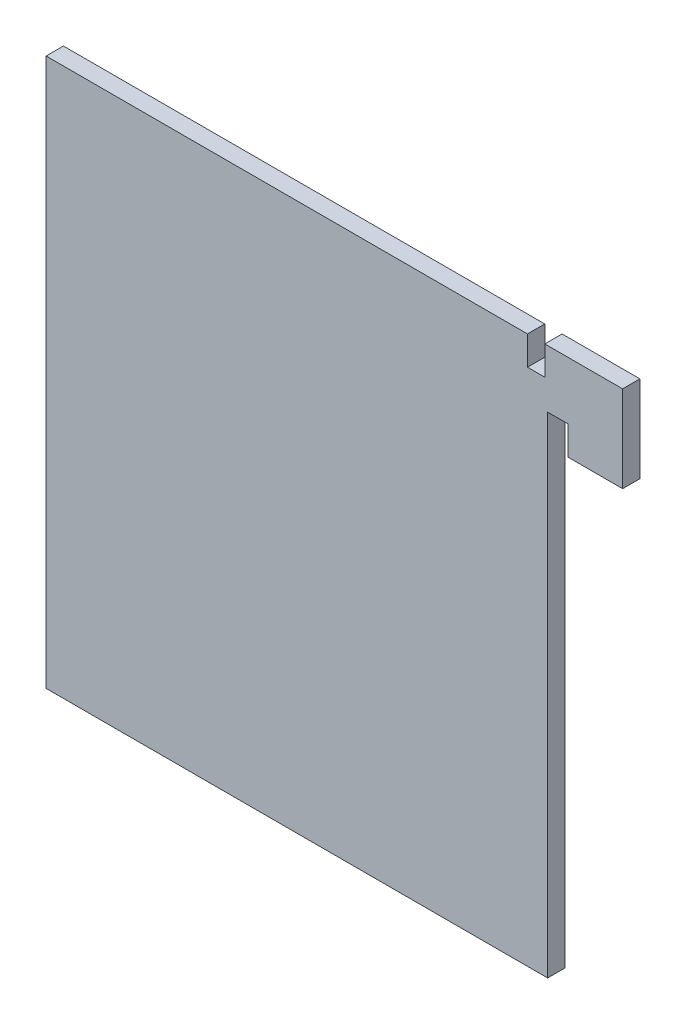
SolidWorks part; units mm, degrees
ref_plane "Plan de face" through (0, 0, 0) normal (0, 0, 1) x (1, 0, 0)
ref_plane "Plan de dessus" through (0, 0, 0) normal (0, 1, 0) x (1, 0, 0)
ref_plane "Plan de droite" through (0, 0, 0) normal (1, 0, 0) x (0, 0, -1)
sketch "Esquisse1" plane through (0, 0, 0) normal (0, 0, 1) x (1, 0, 0)
  line L1 (0, 0) -> (100, 0)
  line L2 (0, 0) -> (0, 95)
  line L3 (0, 95) -> (100, 95)
  line L4 (100, 0) -> (100, 95)
  dimension "D1" = 100
  dimension "D2" = 95
extrude "Extrusion1" add sketch "Esquisse1" along normal blind 3
sketch "Esquisse2" plane through (0, 0, 3) normal (0, 0, 1) x (1, 0, 0)
  line L0 (100, 95) -> (0, 95) construction
  line L1 (83.5, 95) -> (86.5, 95)
  line L2 (83.5, 95) -> (83.5, 90)
  line L3 (83.5, 90) -> (86.5, 90)
  line L4 (86.5, 95) -> (86.5, 90)
  line L5 (100, 0) -> (100, 95) construction
  line L6 (100, 80) -> (87, 80)
  line L7 (100, 80) -> (100, 0)
  line L8 (100, 0) -> (87, 0)
  line L9 (87, 80) -> (87, 0)
  line L10 (0, 0) -> (100, 0) construction
  dimension "D1" = 3
  dimension "D2" = 5
  dimension "D3" = 13.5
  dimension "D4" = 80
  dimension "D5" = 13
extrude "Enlèv. mat.-Extru.1" cut sketch "Esquisse2" against normal blind 3
sketch "Esquisse3" plane through (0, 0, 3) normal (0, 0, 1) x (1, 0, 0)
  line L1 (87, 80) -> (90.5, 80)
  line L2 (87, 80) -> (87, 85)
  line L3 (87, 85) -> (90.5, 85)
  line L4 (90.5, 80) -> (90.5, 85)
  dimension "D1" = 5
  dimension "D2" = 3.5
extrude "Enlèv. mat.-Extru.2" cut sketch "Esquisse3" against normal blind 3
